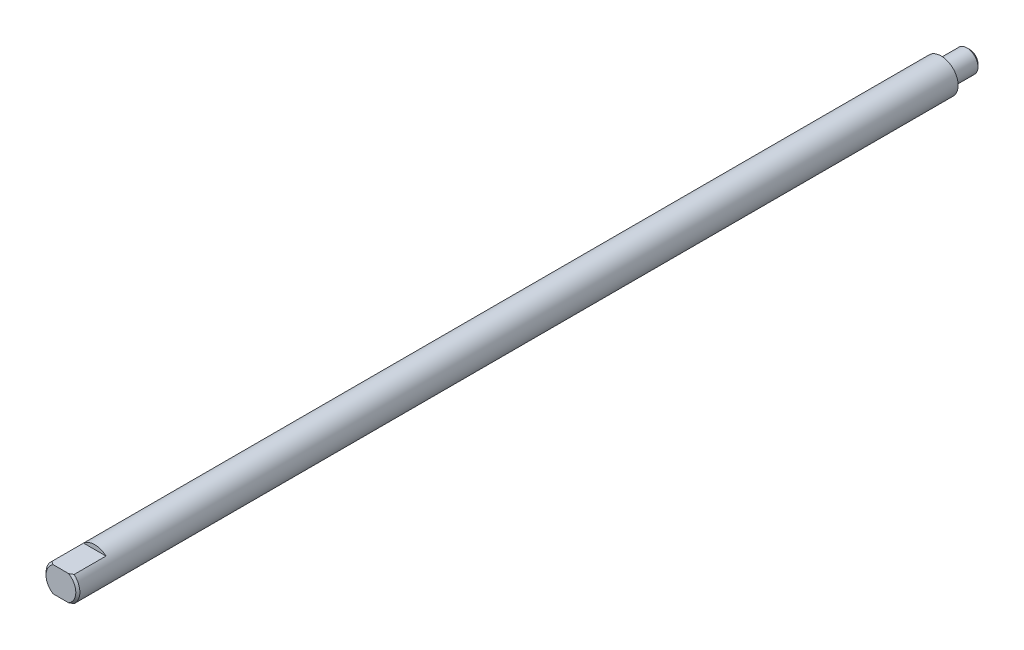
SolidWorks part; units mm, degrees
ref_plane "Front" through (0, 0, 0) normal (0, 0, 1) x (1, 0, 0)
ref_plane "Top" through (0, 0, 0) normal (0, 1, 0) x (1, 0, 0)
ref_plane "Right" through (0, 0, 0) normal (1, 0, 0) x (0, 0, -1)
sketch "Sketch1" plane through (0, 0, 0) normal (1, 0, 0) x (0, 0, -1)
  line L0 (166.37, 1.57) -> (165.86, 2.0828)
  line L1 (-4.064, 0) -> (166.37, 0)
  line L2 (-4.064, 0) -> (-4.064, 2.79)
  line L3 (-3.684, 3.175) -> (161.036, 3.175)
  line L4 (161.036, 2.0828) -> (161.036, 3.175)
  line L5 (153.7208, 0) -> (-49846.2792, 0) construction
  line L6 (-4.064, 2.79) -> (-3.684, 3.175)
  line L7 (161.036, 2.0828) -> (165.86, 2.0828)
  line L8 (166.37, 0) -> (166.37, 1.57)
  point P2 (0, 0)
  dimension "D1" = 165.1
  dimension "D2" = 3.175
  dimension "D3" = 4.1656
  dimension "D4" = 5.334
  dimension "D5" = 1.57
  dimension "D6" = 0.51
  dimension "D7" = 2.79
  dimension "D8" = 0.38
  dimension "D9" = 4.064
revolve "Revolve1" add sketch "Sketch1" angle 360 about L1
sketch "Sketch2" plane through (0, 0, 0) normal (1, 0, 0) x (0, 0, -1)
  line L0 (-4.064, 2.79) -> (-4.064, -2.79) construction
  line L1 (-4.064, 2.375) -> (2.286, 2.375)
  line L2 (-4.064, 2.375) -> (-4.064, 3.175)
  line L3 (-4.064, 3.175) -> (2.286, 3.175)
  line L4 (2.286, 2.375) -> (2.286, 3.175)
  line L5 (161.036, 3.175) -> (-3.684, 3.175) construction
  line L6 (0, 0) -> (6.0811, 0) construction
  line L7 (2.286, -2.375) -> (2.286, -3.175)
  line L8 (-4.064, -3.175) -> (2.286, -3.175)
  line L9 (-4.064, -2.375) -> (-4.064, -3.175)
  line L10 (-4.064, -2.375) -> (2.286, -2.375)
  dimension "D1" = 0.8
  dimension "D2" = 6.35
extrude "Cut-Extrude1" cut sketch "Sketch2" against normal mid plane 10
